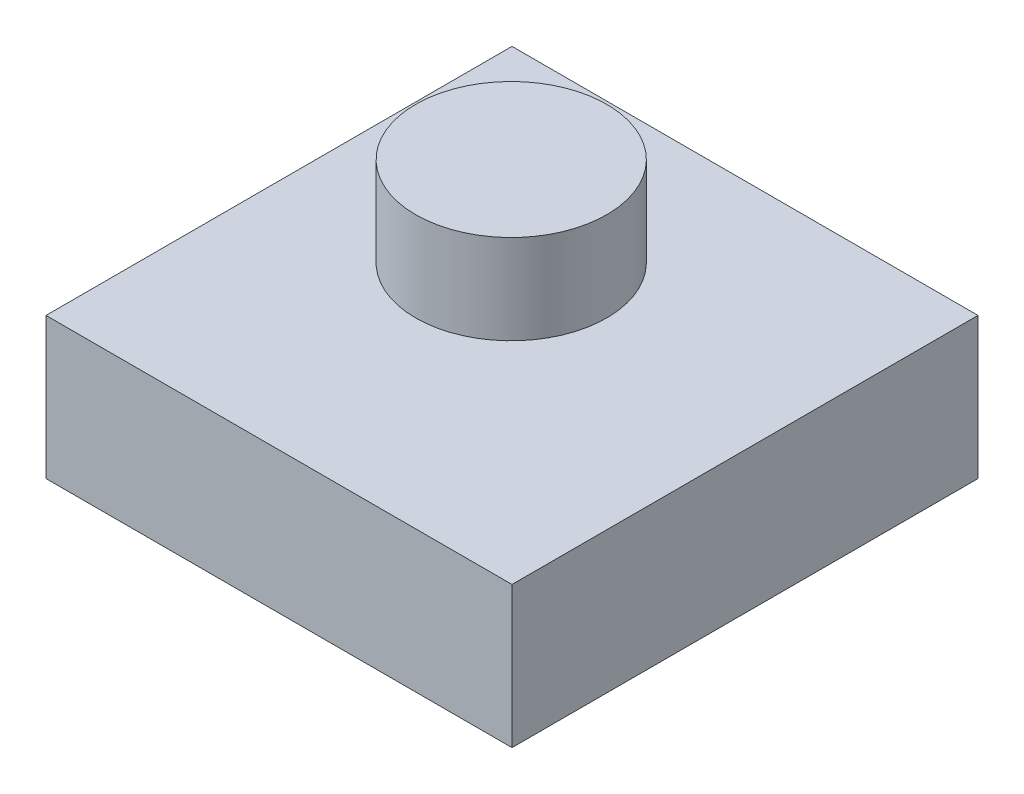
SolidWorks part; units mm, degrees
ref_plane "Front Plane" through (0, 0, 0) normal (0, 0, 1) x (1, 0, 0)
ref_plane "Top Plane" through (0, 0, 0) normal (0, 1, 0) x (1, 0, 0)
ref_plane "Right Plane" through (0, 0, 0) normal (1, 0, 0) x (0, 0, -1)
sketch "Sketch1" plane through (0, 0, 0) normal (0, 1, 0) x (1, 0, 0)
  line L0 (48.7636, -48.7636) -> (-48.7636, 48.7636) construction
  line L1 (-48.7636, 48.7636) -> (48.7636, 48.7636)
  line L2 (-48.7636, 48.7636) -> (-48.7636, -48.7636)
  line L3 (-48.7636, -48.7636) -> (48.7636, -48.7636)
  line L4 (48.7636, 48.7636) -> (48.7636, -48.7636)
extrude "Extrude1" add sketch "Sketch1" along normal blind 29.5775
sketch "Sketch2" plane through (-1.3337, 29.5775, 0) normal (0, 1, 0) x (-1, 0, 0)
  circle A0 centre (8.2833, -9.453) radius 20
extrude "Extrude2" add sketch "Sketch2" along normal blind 18.72
